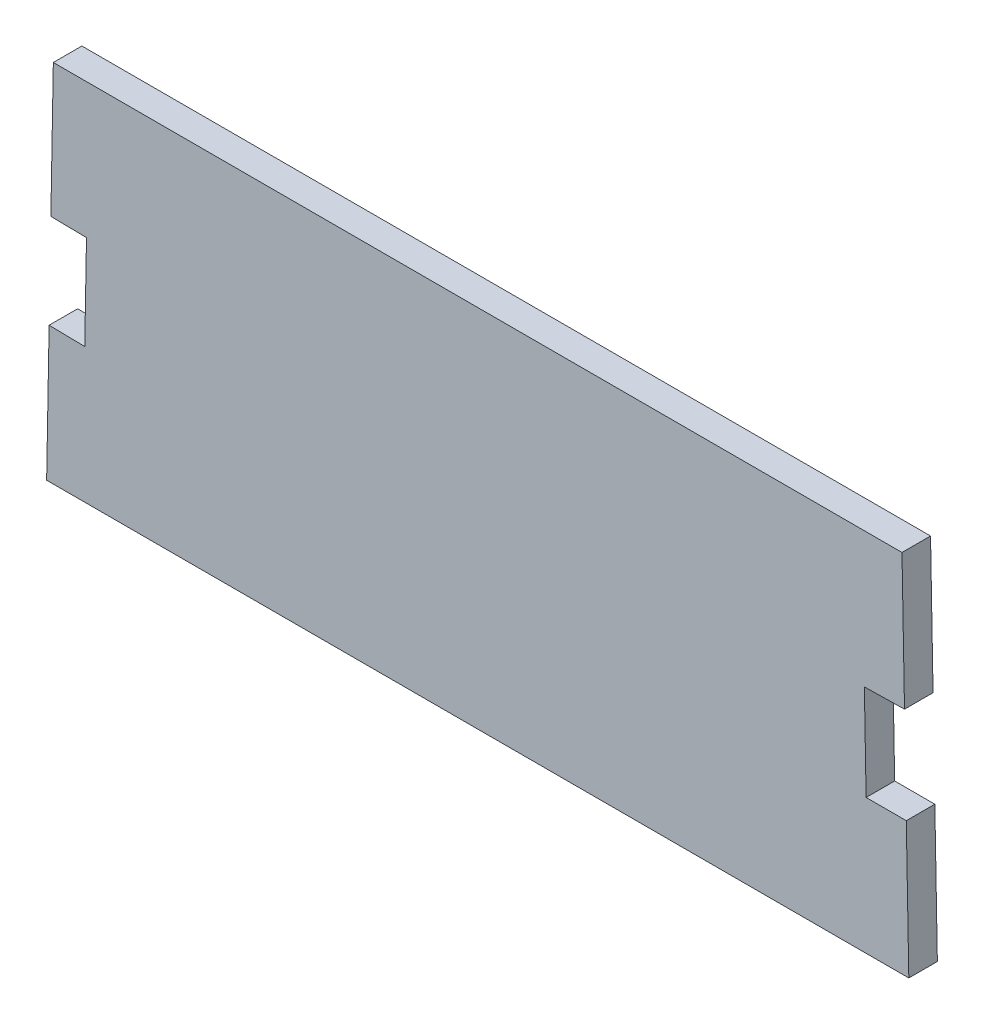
SolidWorks part; units mm, degrees
ref_plane "Front Plane" through (0, 0, 0) normal (0, 0, 1) x (1, 0, 0)
ref_plane "Top Plane" through (0, 0, 0) normal (0, 1, 0) x (1, 0, 0)
ref_plane "Right Plane" through (0, 0, 0) normal (1, 0, 0) x (0, 0, -1)
sketch "Sketch1" plane through (0, 0, 0) normal (0, 0, 1) x (1, 0, 0)
  line L0 (23.0119, -9.7452) -> (22.8771, -2.5396)
  line L1 (-23.0119, -9.7452) -> (23.0119, -9.7452)
  line L2 (-23.0119, -9.7452) -> (-22.8793, -2.5129)
  line L3 (-22.6546, 9.7452) -> (22.6473, 9.7452)
  line L4 (-22.7862, 2.5663) -> (-20.884, 2.5314)
  line L5 (-20.884, 2.5314) -> (-20.9771, -2.5477)
  line L6 (-20.9771, -2.5477) -> (-22.8793, -2.5129)
  line L7 (-22.7862, 2.5663) -> (-22.6546, 9.7452)
  line L8 (22.7816, 2.5657) -> (20.6391, 2.5264)
  line L9 (20.6391, 2.5264) -> (20.732, -2.5396)
  line L10 (20.732, -2.5396) -> (22.8771, -2.5396)
  line L11 (22.7816, 2.5657) -> (22.6473, 9.7452)
extrude "Boss-Extrude1" add sketch "Sketch1" along normal blind 1.524
